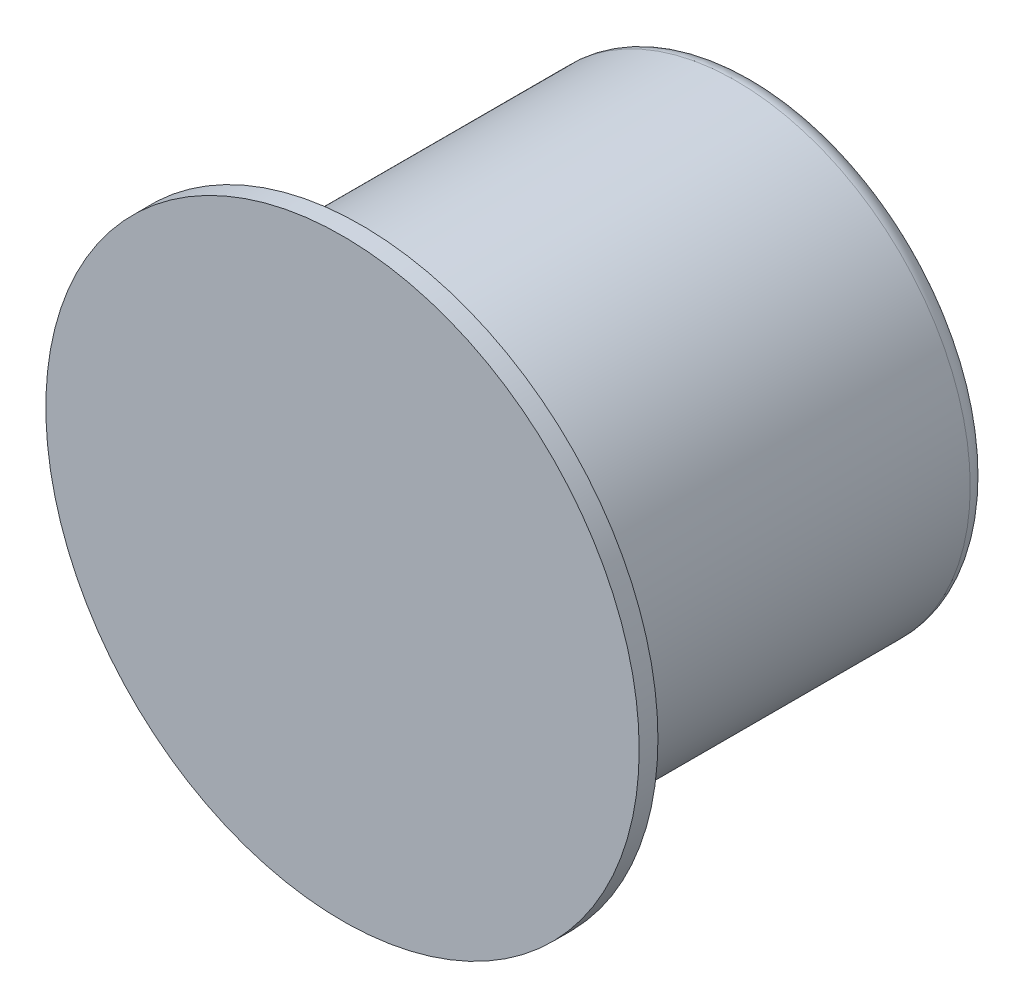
SolidWorks part; units mm, degrees
ref_plane "Front Plane" through (0, 0, 0) normal (0, 0, 1) x (1, 0, 0)
ref_plane "Top Plane" through (0, 0, 0) normal (0, 1, 0) x (1, 0, 0)
ref_plane "Right Plane" through (0, 0, 0) normal (1, 0, 0) x (0, 0, -1)
sketch "Sketch1" plane through (0, 0, 0) normal (1, 0, 0) x (0, 0, -1)
  line L0 (0, 0) -> (66, 0) construction
  line L1 (0, 0) -> (0, 47.5)
  line L2 (0, 47.5) -> (3, 47.5)
  line L3 (3, 47.5) -> (3, 37.5)
  line L4 (3, 37.5) -> (63, 37.5)
  line L5 (66, 34.5) -> (66, 6)
  line L6 (65, 5) -> (54, 5)
  line L7 (54, 5) -> (51.1132, 0)
  line L8 (65, 5) -> (66, 6)
  line L9 (0, 0) -> (51.1132, 0)
  arc A0 (63, 37.5) -> (66, 34.5) centre (63, 34.5) cw
  point P9 (66, 37.5)
  dimension "D4" = 3
  dimension "D11" = 3
  dimension "D2" = 47.5
  dimension "D3" = 37.5
  dimension "D5" = 63
  dimension "D6" = 1
  dimension "D7" = 45
  dimension "D8" = 12
  dimension "D9" = 5
  dimension "D10" = 60
revolve "Revolve1" add sketch "Sketch1" angle 360 about L0
